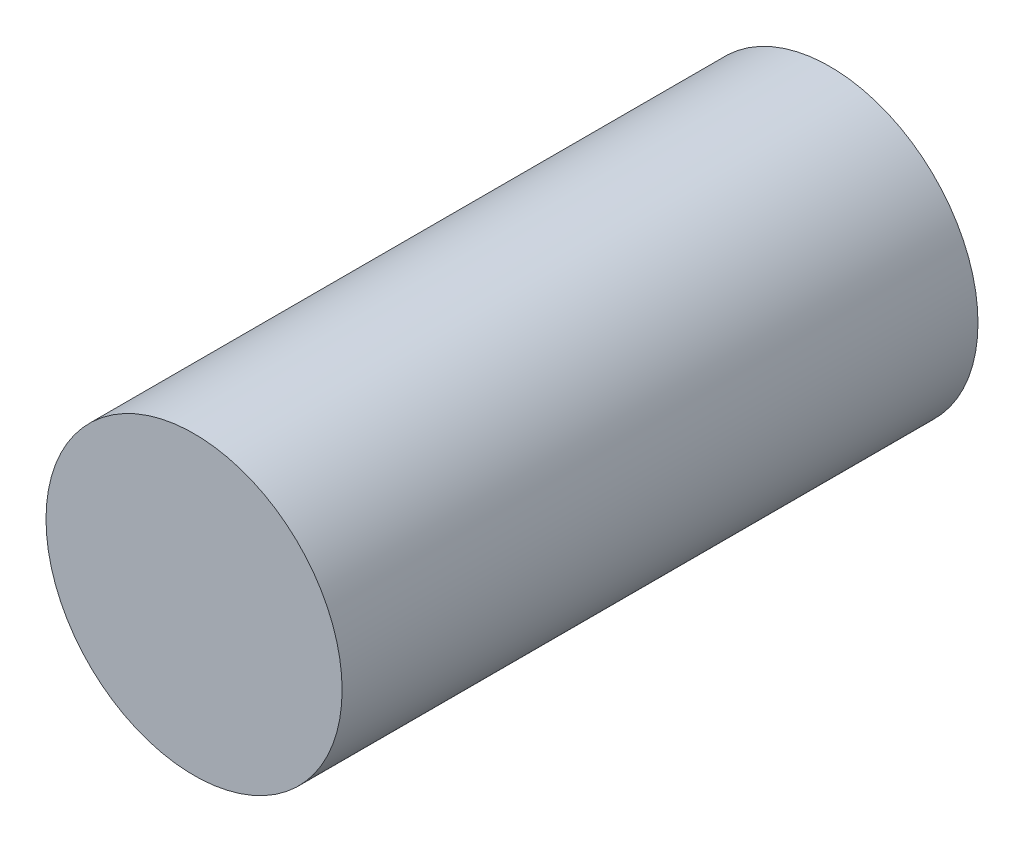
SolidWorks part; units mm, degrees
ref_plane "Front Plane" through (0, 0, 0) normal (0, 0, 1) x (1, 0, 0)
ref_plane "Top Plane" through (0, 0, 0) normal (0, 1, 0) x (1, 0, 0)
ref_plane "Right Plane" through (0, 0, 0) normal (1, 0, 0) x (0, 0, -1)
sketch "Sketch1"
extrude "Extrude1" add sketch "Sketch1" against normal blind 27.432
